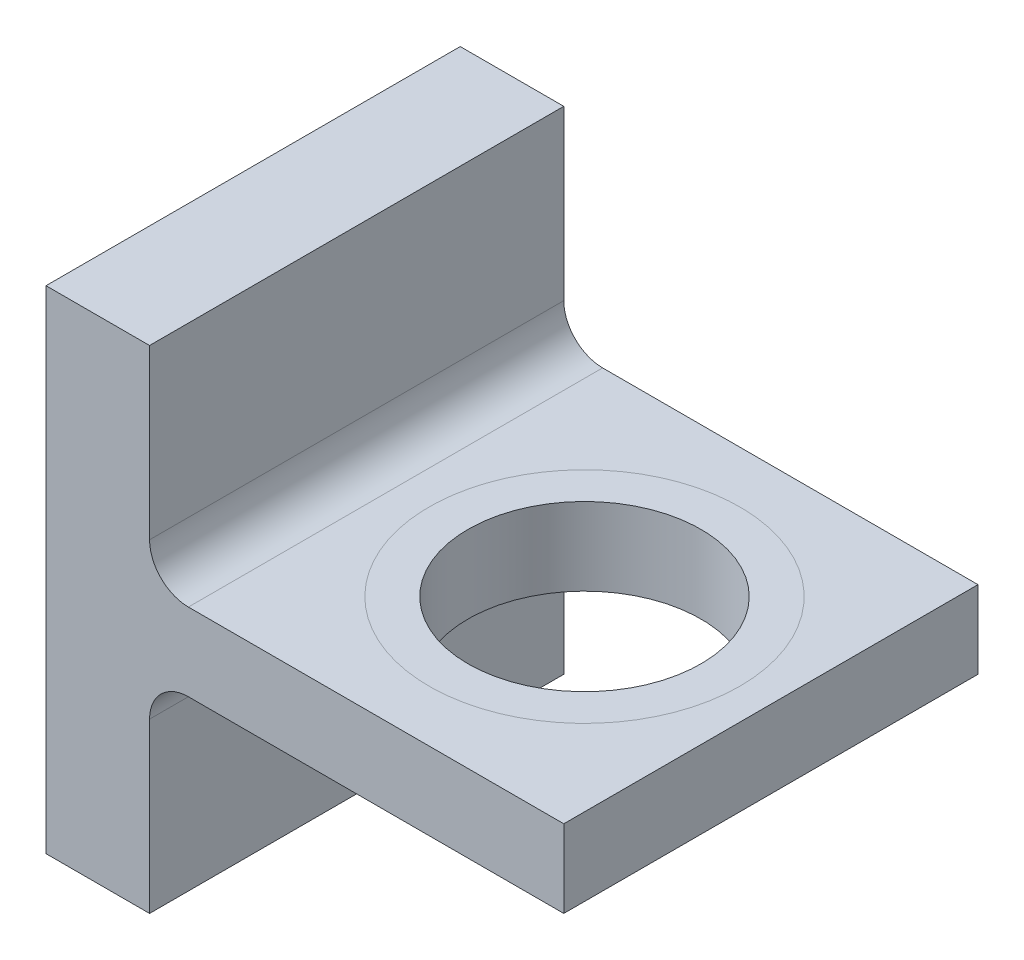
SolidWorks part; units mm, degrees
ref_plane "Front" through (0, 0, 0) normal (0, 0, 1) x (1, 0, 0)
ref_plane "Top" through (0, 0, 0) normal (0, 1, 0) x (1, 0, 0)
ref_plane "Right" through (0, 0, 0) normal (1, 0, 0) x (0, 0, -1)
sketch "Sketch1" plane through (0, 0, 0) normal (0, 0, 1) x (1, 0, 0)
  line L0 (-37.5011, 0) -> (161.7614, 0) construction
  line L1 (0, -60.325) -> (25.4, -60.325)
  line L2 (0, 60.325) -> (25.4, 60.325)
  line L3 (0, 60.325) -> (0, -60.325)
  line L4 (25.4, -60.325) -> (25.4, -9.525)
  line L5 (25.4, -9.525) -> (127, -9.525)
  line L6 (25.4, 9.525) -> (127, 9.525)
  line L7 (127, 9.525) -> (127, -9.525)
  line L8 (25.4, 60.325) -> (25.4, 9.525)
  point P13 (25.4, 9.525)
  point P15 (25.4, -9.525)
  dimension "D1" = 25.4
  dimension "D2" = 120.65
  dimension "D4" = 19.05
  dimension "D5" = 101.6
extrude "Base-Extrude" add sketch "Sketch1" along normal mid plane 101.6
sketch "Sketch6" plane through (0, 0, 0) normal (0, 1, 0) x (1, 0, 0)
  line L0 (-21.254, 0) -> (140.9841, 0) construction
  line L7 (127, -50.8) -> (127, 50.8) construction
  circle A0 centre (81.28, 0) radius 28.575
  dimension "D1" = 57.15
  dimension "D2" = 45.72
extrude "Cut-Extrude8" cut sketch "Sketch6" against normal through all and the other way through all
sketch "Sketch8" plane through (0, 0, 50.8) normal (0, 0, 1) x (1, 0, 0)
  line L0 (-21.5788, 0) -> (140.8806, 0) construction
  line L1 (0, 44.45) -> (6.35, 44.45)
  line L2 (0, 60.325) -> (0, -60.325) construction
  line L3 (0, -44.45) -> (6.35, -44.45)
  line L4 (6.35, 44.45) -> (6.35, -44.45)
  line L5 (0, 44.45) -> (0, -44.45)
  dimension "D1" = 6.35
  dimension "D2" = 88.9
extrude "Cut-Extrude6" [suppressed] cut sketch "Sketch8" against normal through all
sketch "Sketch10" plane through (0, 9.525, 0) normal (0, 1, 0) x (-1, 0, 0)
  circle A0 centre (-81.28, 0) radius 38.1
  circle A1 centre (-81.28, 0) radius 28.575 construction
  dimension "D1" = 76.2
fillet "Fillet6" radius 9.525 2 edges at (25.4, -9.525, 0) (25.4, 9.525, 0)
fillet "Fillet7" [suppressed] radius 6.35
fillet "Fillet8" [suppressed] radius 1.27
sketch "Sketch9" plane through (0, 0, 0) normal (0, 1, 0) x (1, 0, 0)
  line L0 (-41.9226, 0) -> (152.8275, 0)
extrude "symmetry cut" [suppressed] cut sketch "Sketch9" against normal through all and the other way through all flip side to cut
